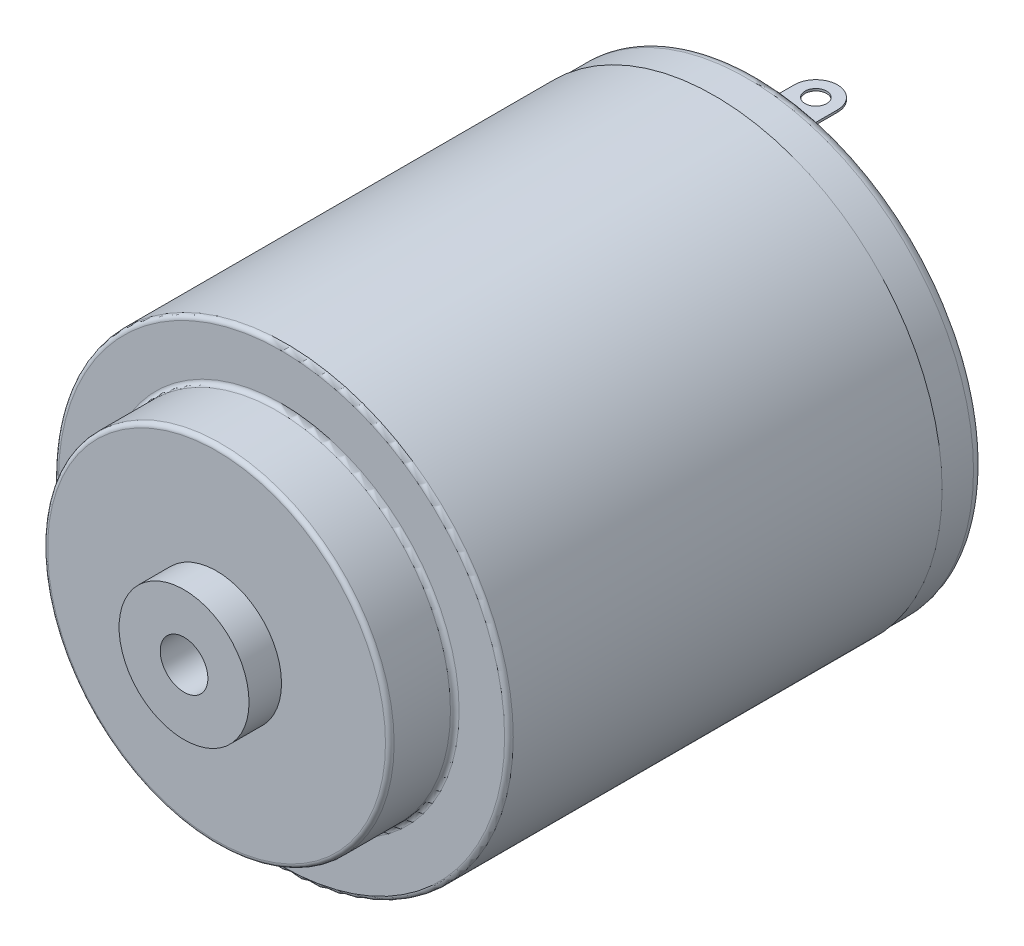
SolidWorks part; units mm, degrees
ref_plane "Plan de face" through (0, 0, 0) normal (0, 0, 1) x (1, 0, 0)
ref_plane "Plan de dessus" through (0, 0, 0) normal (0, 1, 0) x (1, 0, 0)
ref_plane "Plan de droite" through (0, 0, 0) normal (1, 0, 0) x (0, 0, -1)
sketch "Esquisse1" plane through (0, 0, 0) normal (0, 0, 1) x (1, 0, 0)
  circle A0 centre (0, 0) radius 10.5
  dimension "D1" = 21
extrude "Extrusion1" add sketch "Esquisse1" along normal blind 20
sketch "Esquisse2" plane through (0, 0, 20) normal (0, 0, 1) x (1, 0, 0)
  circle A0 centre (0, 0) radius 8
  dimension "D1" = 16
extrude "Extrusion2" add sketch "Esquisse2" along normal blind 3
sketch "Esquisse3" plane through (0, 0, 23) normal (0, 0, 1) x (1, 0, 0)
  circle A0 centre (0, 0) radius 3
  dimension "D1" = 6
extrude "Extrusion3" add sketch "Esquisse3" along normal blind 1.5
sketch "Esquisse4" plane through (0, 0, 24.5) normal (0, 0, 1) x (1, 0, 0)
  circle A0 centre (0, 0) radius 1.1
  dimension "D1" = 2.2
fillet "Congé1" radius 0.2 3 edges at (10.5, 0, 20) (8, 0, 20) (8, 0, 23)
sketch "Esquisse5" plane through (0, 0, 0) normal (0, 0, -1) x (-1, 0, 0)
  circle A0 centre (0, 0) radius 10.45
  dimension "D1" = 20.9
extrude "Extrusion5" add sketch "Esquisse5" along normal blind 2
fillet "Congé5" radius 0.5 1 edges at (-10.45, 0, -2)
sketch "Esquisse6" plane through (0, 0, -2) normal (0, 0, -1) x (-1, 0, 0)
  line L0 (0, 9.1558) -> (0, -9.1558) construction
  line L1 (-1.75, 3.0311) -> (-1.75, 6.26)
  line L2 (-1.75, -3.0311) -> (-1.75, -6.26)
  line L3 (1.75, 6.26) -> (1.75, 3.0311)
  line L4 (1.75, -3.0311) -> (1.75, -6.26)
  arc A0 (1.75, -6.26) -> (1.75, 6.26) centre (0, 0) ccw
  arc A1 (1.75, -3.0311) -> (1.75, 3.0311) centre (0, 0) ccw
  arc A2 (-1.75, 3.0311) -> (-1.75, -3.0311) centre (0, 0) ccw
  arc A3 (-1.75, 6.26) -> (-1.75, -6.26) centre (0, 0) ccw
  dimension "D1" = 13
  dimension "D2" = 7
  dimension "D3" = 1.75
extrude "Enlèv. mat.-Extru.1" cut sketch "Esquisse6" against normal blind 0.5
sketch "Esquisse7" plane through (0, 0, -2) normal (0, 0, -1) x (-1, 0, 0)
  line L0 (-1.9182, 2.3067) -> (1.9182, 2.3067)
  arc A0 (-1.9182, 2.3067) -> (1.9182, 2.3067) centre (0, 0) ccw
  dimension "D1" = 6
extrude "Extrusion7" add sketch "Esquisse7" along normal blind 2
sketch "Esquisse8" plane through (0, 0, -4) normal (0, 0, -1) x (-1, 0, 0)
  circle A0 centre (0, 0) radius 1.5
  dimension "D1" = 3
extrude "Enlèv. mat.-Extru.2" cut sketch "Esquisse8" against normal blind 1
ref_plane "Plan1" through (0, 8, 0) normal (0, 1, 0) x (-1, 0, 0)
sketch "Esquisse10" plane through (0, 8, 0) normal (0, 1, 0) x (-1, 0, 0)
  line L1 (-1, -0.9359) -> (1, -0.9359)
  line L2 (0, 7.0679) -> (0, -6.5004) construction
  line L3 (-1, -0.9359) -> (-1, -4.671)
  line L5 (1, -0.9359) -> (1, -4.671)
  arc A0 (-1, -4.671) -> (1, -4.671) centre (0, -4.671) ccw
extrude "Extrusion9" add sketch "Esquisse10" along normal blind 0.1
sketch "Esquisse11" plane through (0, 8.1, 0) normal (0, 1, 0) x (-1, 0, 0)
  line L0 (0, -1.5659) -> (0, -6.5367) construction
  line L1 (1, -4.671) -> (-2.2205, -4.671) construction
  line L2 (-1, -2) -> (-1, -4.671) construction
  circle A0 centre (0, -4.671) radius 0.5
  dimension "D1" = 1
  dimension "D2" = 1
extrude "Enlèv. mat.-Extru.3" cut sketch "Esquisse11" against normal through all
ref_plane "Plan2" through (0, -8, 0) normal (0, 1, 0) x (-1, 0, 0)
sketch "Esquisse12" plane through (0, -8, 0) normal (0, 1, 0) x (-1, 0, 0)
  line L0 (0, -8.3673) -> (0, 3.7561) construction
  line L1 (-9.95, -2) -> (9.95, -2) construction
  line L2 (1, -2) -> (-1, -2)
  line L3 (1, -2) -> (1, -4.671)
  line L5 (-1, -2) -> (-1, -4.671)
  arc A0 (-1, -4.671) -> (1, -4.671) centre (0, -4.671) ccw construction
  arc A1 (1, -4.671) -> (-1, -4.671) centre (0, -4.671) cw
extrude "Extrusion10" add sketch "Esquisse12" along normal blind 0.1
sketch "Esquisse13" plane through (0, -8, 0) normal (0, -1, 0) x (1, 0, 0)
  line L0 (0, -6.2421) -> (0, -3.4623) construction
  line L1 (-1, -4.671) -> (1.1921, -4.671) construction
  circle A0 centre (0, -4.671) radius 0.5
  dimension "D1" = 1
extrude "Enlèv. mat.-Extru.4" cut sketch "Esquisse13" against normal through all
extrude "Enlèv. mat.-Extru.6" cut sketch "Esquisse4" against normal through all
